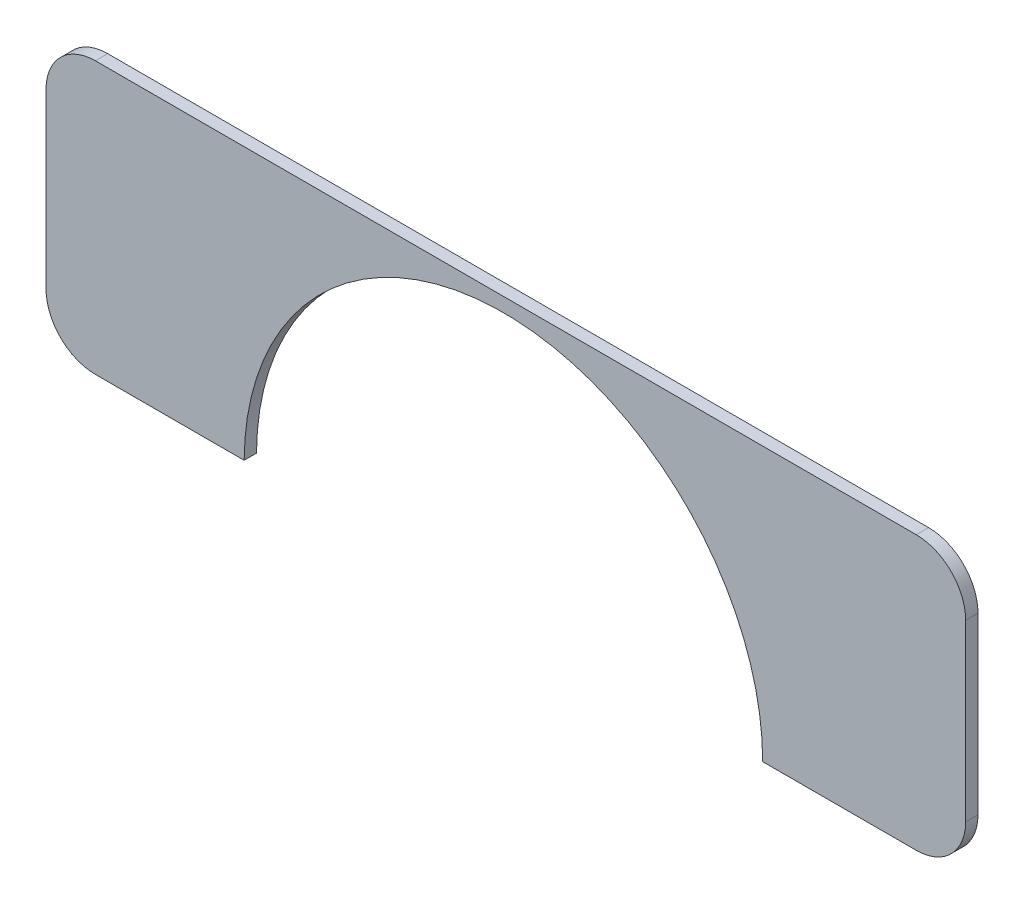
SolidWorks part; units mm, degrees
ref_plane "Front Plane" through (0, 0, 0) normal (0, 0, 1) x (1, 0, 0)
ref_plane "Top Plane" through (0, 0, 0) normal (0, 1, 0) x (1, 0, 0)
ref_plane "Right Plane" through (0, 0, 0) normal (1, 0, 0) x (0, 0, -1)
sketch "Sketch1" plane through (0, 0, 0) normal (0, 0, 1) x (1, 0, 0)
  line L0 (0, 109.22) -> (-52.197, 109.22)
  line L1 (0, 69.85) -> (0, 219.3279) construction
  line L2 (-55.372, 109.22) -> (-52.197, 109.22) construction
  line L3 (-185.5455, 109.664) -> (-236.5, 109.664)
  line L4 (-236.5, 219.3279) -> (-236.5, 0) construction
  line L5 (-236.5, 109.664) -> (-236.5, 179.514)
  line L6 (-236.5, 179.514) -> (0, 179.514)
  line L7 (0, 179.514) -> (0, 109.22)
  arc A0 (-52.197, 109.22) -> (-185.547, 109.22) centre (-118.872, 109.22) ccw construction
  arc A1 (-52.197, 109.22) -> (-185.5455, 109.664) centre (-118.872, 109.22) ccw
  dimension "D1" = 69.85
extrude "Boss-Extrude1" add sketch "Sketch1" along normal blind 3.175
fillet "Fillet1" radius 12.7 4 edges at (-236.5, 179.514, 1.5875) (-236.5, 109.664, 1.5875) (0, 179.514, 1.5875) (0, 109.22, 1.5875)
